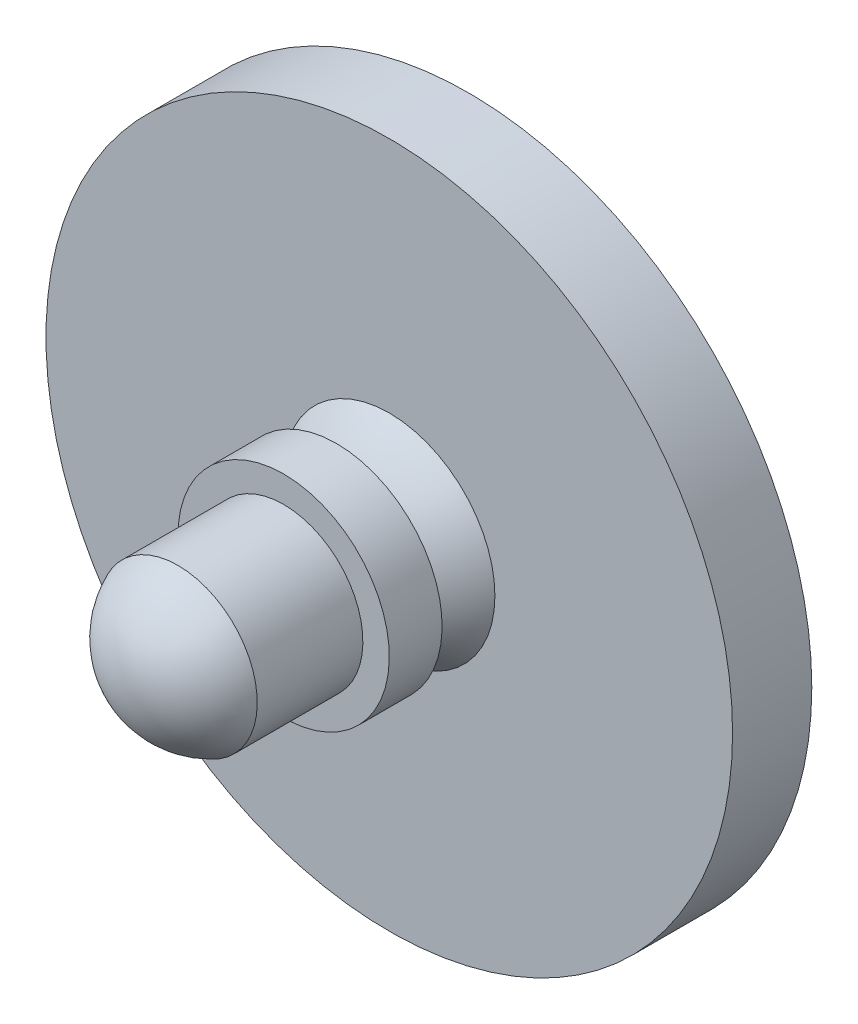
SolidWorks part; units mm, degrees
ref_plane "Face" through (0, 0, 0) normal (0, 0, 1) x (1, 0, 0)
ref_plane "Dessus" through (0, 0, 0) normal (0, 1, 0) x (1, 0, 0)
ref_plane "Droite" through (0, 0, 0) normal (1, 0, 0) x (0, 0, -1)
sketch "Esquisse1" plane through (0, 0, 0) normal (0, 0, 1) x (1, 0, 0)
  circle A0 centre (0, 0) radius 6.5
  dimension "D1" = 13
extrude "Extrusion1" add sketch "Esquisse1" along normal blind 1.5
sketch "Esquisse3" plane through (0, 0, 0) normal (0, 1, 0) x (1, 0, 0)
  line L0 (0, 0) -> (0, 4) construction
  line L1 (6.5, 0) -> (-6.5, 0) construction
  line L2 (2.5, 0) -> (0, 0)
  line L3 (0, 0) -> (0, 2)
  arc A0 (0, 2) -> (2.5, 0) centre (0, -0.5625) cw
  dimension "D1" = 2
  dimension "D2" = 2.5
revolve "Révolution4" add sketch "Esquisse3" angle 360 about L0
sketch "Esquisse4" plane through (0, 0, 0) normal (1, 0, 0) x (0, 0, -1)
  line L0 (0, 0) -> (-5, 0) construction
  line L1 (-1.5, 6.5) -> (-1.5, -6.5) construction
  line L2 (-1.5, 2) -> (-1.5, 0)
  line L3 (-1.5, 0) -> (-2.5, 0)
  arc A0 (-2.5, 0) -> (-1.5, 2) centre (0, 0) cw
  dimension "D1" = 2.5
revolve "Révolution5" add sketch "Esquisse4" angle 360 about L0
sketch "Esquisse5" plane through (0, 0, 0) normal (1, 0, 0) x (0, 0, -1)
  line L0 (0, 0) -> (-6.5, 0) construction
  line L1 (-2.5, 0) -> (-2.5, 2)
  line L2 (-2.5, 2) -> (-3.5, 2)
  line L3 (-3.5, 2) -> (-3.5, 1.5)
  line L4 (-3.5, 1.5) -> (-5.5, 1.5)
  line L5 (-2.5, 0) -> (-6.5, 0)
  arc A0 (-6.5, 0) -> (-5.5, 1.5) centre (-4.875, 0) cw
  dimension "D1" = 2
  dimension "D2" = 2.5
  dimension "D3" = 1
  dimension "D4" = 4
  dimension "D5" = 2
  dimension "D6" = 1.5
revolve "Révolution6" add sketch "Esquisse5" angle 360 about L0
